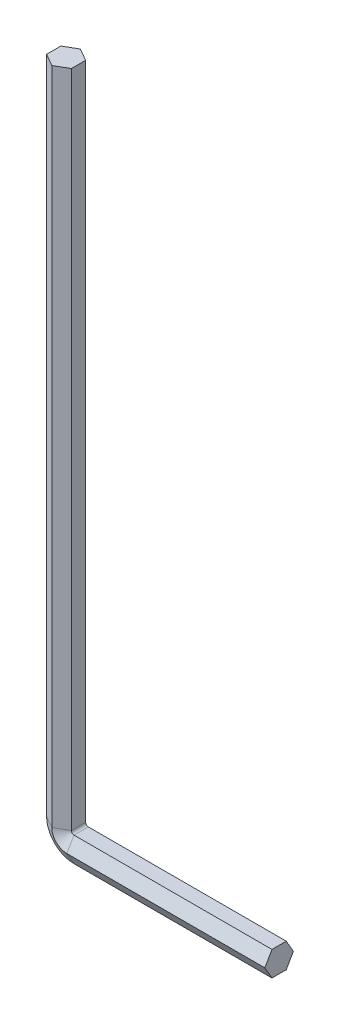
SolidWorks part; units mm, degrees
ref_plane "Front Plane" through (0, 0, 0) normal (0, 0, 1) x (1, 0, 0)
ref_plane "Top Plane" through (0, 0, 0) normal (0, 1, 0) x (1, 0, 0)
ref_plane "Right Plane" through (0, 0, 0) normal (1, 0, 0) x (0, 0, -1)
sketch "Sketch1" plane through (0, 0, 0) normal (0, 0, 1) x (1, 0, 0)
  line L0 (-26.7172, 0) -> (-4.1552, 0) construction
  line L1 (0, 0) -> (-19.05, 0)
  line L3 (-20.4952, 1.4452) -> (-20.4952, 64.9452)
  arc A0 (-19.05, 0) -> (-20.4952, 1.4452) centre (-19.05, 1.4452) cw
  dimension "D1" = 63.5
  dimension "D2" = 19.05
sketch "Sketch2" plane through (0, 0, 0) normal (1, 0, 0) x (0, 0, -1)
  line L1 (1.3748, 0) -> (0.6874, 1.1906)
  line L2 (0.6874, 1.1906) -> (-0.6874, 1.1906)
  line L3 (-0.6874, 1.1906) -> (-1.3748, 0)
  line L4 (-1.3748, 0) -> (-0.6874, -1.1906)
  line L5 (-0.6874, -1.1906) -> (0.6874, -1.1906)
  line L6 (0.6874, -1.1906) -> (1.3748, 0)
  circle A0 centre (0, 0) radius 1.1906 construction
  dimension "D1" = 2.3813
sweep "Sweep3" add profiles "Sketch2" path "Sketch1"
